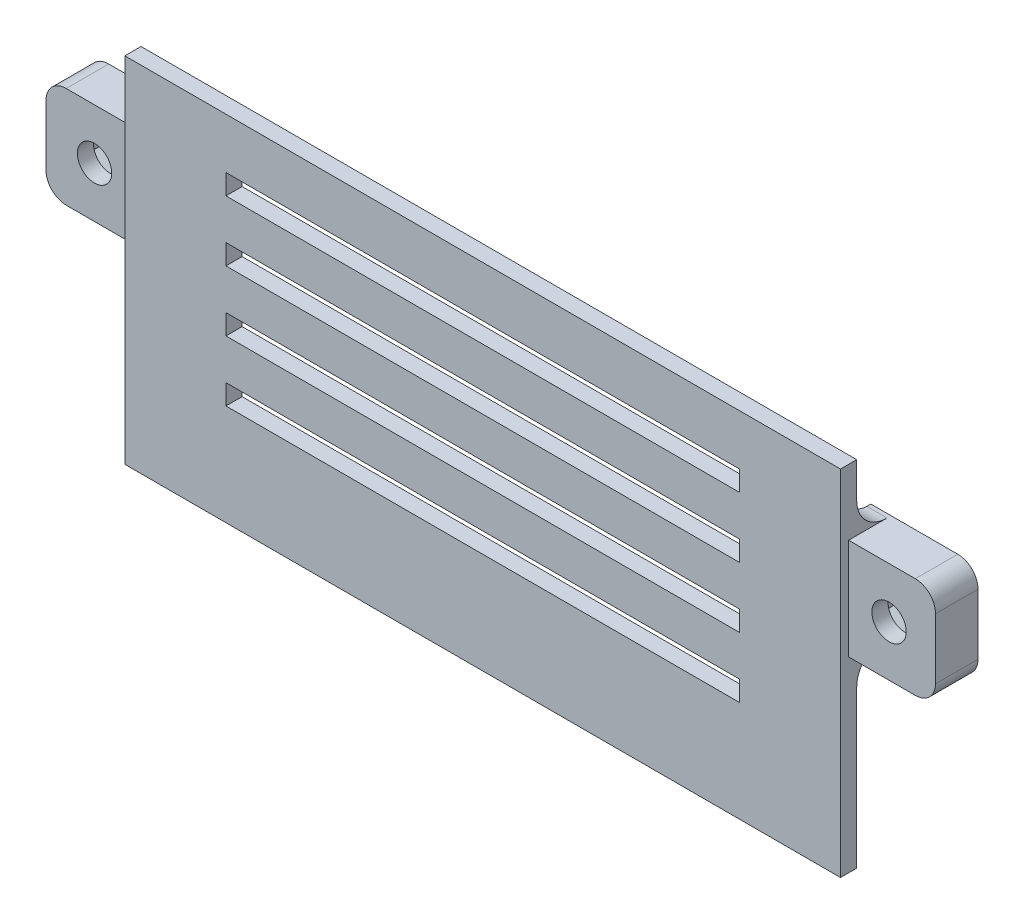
SolidWorks part; units mm, degrees
ref_plane "Front Plane" through (0, 0, 0) normal (0, 0, 1) x (1, 0, 0)
ref_plane "Top Plane" through (0, 0, 0) normal (0, 1, 0) x (1, 0, 0)
ref_plane "Right Plane" through (0, 0, 0) normal (1, 0, 0) x (0, 0, -1)
sketch "Sketch1" plane through (0, 0, 0) normal (0, 0, 1) x (1, 0, 0)
  line L1 (-33.3242, -0.0358) -> (37.4758, -0.0358)
  line L2 (-33.3242, -0.0358) -> (-33.3242, -35.0358)
  line L3 (-33.3242, -35.0358) -> (37.4758, -35.0358)
  line L4 (37.4758, -0.0358) -> (37.4758, -35.0358)
  line L5 (-23.3242, -5.0358) -> (27.4758, -5.0358)
  line L6 (-23.3242, -5.0358) -> (-23.3242, -7.0358)
  line L7 (-23.3242, -7.0358) -> (27.4758, -7.0358)
  line L8 (27.4758, -5.0358) -> (27.4758, -7.0358)
  line L9 (-23.3242, -11.0358) -> (27.4758, -11.0358)
  line L10 (-23.3242, -11.0358) -> (-23.3242, -13.0358)
  line L11 (-23.3242, -13.0358) -> (27.4758, -13.0358)
  line L12 (27.4758, -11.0358) -> (27.4758, -13.0358)
  line L13 (-23.3242, -17.0358) -> (27.4758, -17.0358)
  line L14 (-23.3242, -17.0358) -> (-23.3242, -19.0358)
  line L15 (-23.3242, -19.0358) -> (27.4758, -19.0358)
  line L16 (27.4758, -17.0358) -> (27.4758, -19.0358)
  line L17 (-23.3242, -23.0358) -> (27.4758, -23.0358)
  line L18 (-23.3242, -23.0358) -> (-23.3242, -25.0358)
  line L19 (-23.3242, -25.0358) -> (27.4758, -25.0358)
  line L20 (27.4758, -23.0358) -> (27.4758, -25.0358)
  dimension "D1" = 70.8
  dimension "D2" = 2
  dimension "D3" = 2
  dimension "D4" = 2
  dimension "D5" = 35
  dimension "D6" = 5
  dimension "D7" = 4
  dimension "D8" = 4
  dimension "D9" = 2
  dimension "D10" = 4
  dimension "D11" = 10
  dimension "D12" = 10
extrude "Boss-Extrude1" add sketch "Sketch1" along normal blind 1.6
sketch "Sketch2" plane through (0, 0, 0) normal (0, 0, 1) x (1, 0, 0)
  line L1 (-33.3242, -6.5358) -> (-41.9242, -6.5358)
  line L2 (-33.3242, -6.5358) -> (-33.3242, -16.5358)
  line L3 (-33.3242, -16.5358) -> (-41.9242, -16.5358)
  line L4 (-41.9242, -6.5358) -> (-41.9242, -16.5358)
  line L5 (37.4758, -6.5358) -> (46.0758, -6.5358)
  line L6 (37.4758, -6.5358) -> (37.4758, -16.5358)
  line L7 (37.4758, -16.5358) -> (46.0758, -16.5358)
  line L8 (46.0758, -6.5358) -> (46.0758, -16.5358)
  line L11 (-33.3242, -0.0358) -> (-33.3242, -35.0358) construction
  line L12 (37.4758, -35.0358) -> (37.4758, -0.0358) construction
  line L13 (37.4758, -0.0358) -> (-33.3242, -0.0358) construction
  point P28 (-41.9242, -11.5358)
  point P29 (46.0758, -11.5358)
  dimension "D1" = 8.6
  dimension "D2" = 8.6
  dimension "D3" = 10
  dimension "D4" = 11.5
  dimension "D5" = 11.5
  dimension "D6" = 10
extrude "Boss-Extrude2" add sketch "Sketch2" along normal blind 1.6 and the other way blind 3.4
ref_plane "Plane1" through (0, 0, 1.6) normal (0, 0, 1) x (1, 0, 0)
sketch "Sketch5" plane through (0, 0, 0) normal (0, 0, 1) x (1, 0, 0)
  line L0 (-33.3242, -6.5358) -> (-41.9242, -6.5358) construction
  line L1 (-33.3242, -16.5358) -> (-31.3242, -16.5358)
  line L2 (-33.3242, -16.5358) -> (-33.3242, -6.5358)
  line L3 (-33.3242, -6.5358) -> (-31.3242, -6.5358)
  line L4 (-31.3242, -16.5358) -> (-31.3242, -6.5358)
  line L5 (37.4758, -16.5358) -> (35.4758, -16.5358)
  line L6 (37.4758, -16.5358) -> (37.4758, -6.5358)
  line L7 (37.4758, -6.5358) -> (35.4758, -6.5358)
  line L8 (35.4758, -16.5358) -> (35.4758, -6.5358)
  line L9 (-33.3242, -16.5358) -> (-33.3242, -6.5358) construction
  dimension "D1" = 2
  dimension "D2" = 2
extrude "Boss-Extrude3" add sketch "Sketch5" against normal up to surface (3.4 mm away)
sketch "Sketch6" plane through (0, 0, 1.6) normal (0, 0, 1) x (1, 0, 0)
  line L1 (-41.9242, -6.5358) -> (-33.3242, -6.5358)
  line L2 (-41.9242, -6.5358) -> (-41.9242, -16.5358)
  line L3 (-41.9242, -16.5358) -> (-33.3242, -16.5358)
  line L4 (-33.3242, -6.5358) -> (-33.3242, -16.5358)
  line L5 (46.0758, -6.5358) -> (37.4758, -6.5358)
  line L6 (46.0758, -6.5358) -> (46.0758, -16.5358)
  line L7 (46.0758, -16.5358) -> (37.4758, -16.5358)
  line L8 (37.4758, -6.5358) -> (37.4758, -16.5358)
extrude "Cut-Extrude1" cut sketch "Sketch6" against normal blind 0.8
ref_plane "Plane2" through (0, 0, -3.4) normal (0, 0, -1) x (-1, 0, 0)
sketch "Sketch3" plane through (0, 0, 0) normal (0, 0, 1) x (1, 0, 0)
  line L1 (-41.9242, -0.0358) -> (-41.9242, -35.0358) construction
  line L4 (-31.3242, -6.5358) -> (-41.9242, -6.5358) construction
  circle A0 centre (-37.1242, -11.5358) radius 1.7
  circle A2 centre (41.4758, -11.5358) radius 1.7
  dimension "D1" = 3.4
  dimension "D2" = 3.4
  dimension "D3" = 5
  dimension "D4" = 4.8
  dimension "D7" = 78.6
sketch "Sketch7" plane through (0, 0, -3.4) normal (0, 0, -1) x (-1, 0, 0)
  line L1 (37.1242, -14.7689) -> (39.9242, -13.1524)
  line L2 (39.9242, -13.1524) -> (39.9242, -9.9192)
  line L3 (39.9242, -9.9192) -> (37.1242, -8.3026)
  line L4 (37.1242, -8.3026) -> (34.3242, -9.9192)
  line L5 (34.3242, -9.9192) -> (34.3242, -13.1524)
  line L6 (34.3242, -13.1524) -> (37.1242, -14.7689)
  line L7 (-41.4758, -14.7689) -> (-38.6758, -13.1524)
  line L8 (-38.6758, -13.1524) -> (-38.6758, -9.9192)
  line L9 (-38.6758, -9.9192) -> (-41.4758, -8.3026)
  line L10 (-41.4758, -8.3026) -> (-44.2758, -9.9192)
  line L11 (-44.2758, -9.9192) -> (-44.2758, -13.1524)
  line L12 (-44.2758, -13.1524) -> (-41.4758, -14.7689)
  circle A0 centre (37.1242, -11.5358) radius 2.8 construction
  circle A1 centre (-41.4758, -11.5358) radius 2.8 construction
  dimension "D1" = 5.6
  dimension "D2" = 5.6
extrude "Cut-Extrude2" cut sketch "Sketch7" against normal blind 2.6
extrude "Cut-Extrude3" cut sketch "Sketch3" against normal blind 11.6 and the other way blind 10
fillet "Fillet1" radius 3 6 edges at (36.4758, -16.5358, 0) (35.4758, -11.5358, 0) (36.4758, -6.5358, 0) (-32.3242, -6.5358, 0) (-31.3242, -11.5358, 0) (-32.3242, -16.5358, 0)
fillet "Fillet2" radius 2 4 edges at (46.0758, -16.5358, -1.3) (46.0758, -6.5358, -1.3) (-41.9242, -6.5358, -1.3) (-41.9242, -16.5358, -1.3)
